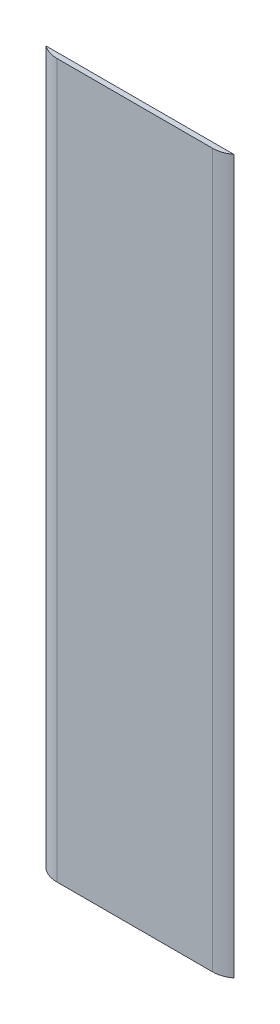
SolidWorks part; units mm, degrees
ref_plane "정면" through (0, 0, 0) normal (0, 0, 1) x (1, 0, 0)
ref_plane "윗면" through (0, 0, 0) normal (0, 1, 0) x (1, 0, 0)
ref_plane "우측면" through (0, 0, 0) normal (1, 0, 0) x (0, 0, -1)
sketch "스케치1" plane through (0, 0, 0) normal (0, 0, 1) x (1, 0, 0)
  line L1 (-17.5, -66.5) -> (17.5, -66.5)
  line L2 (-17.5, -66.5) -> (-17.5, 66.5)
  line L3 (-17.5, 66.5) -> (17.5, 66.5)
  line L4 (17.5, -66.5) -> (17.5, 66.5)
  line L5 (-17.5, -66.5) -> (17.5, 66.5) construction
  line L6 (-17.5, 66.5) -> (17.5, -66.5) construction
  point P0 (0, 0)
  dimension "D1" = 35
  dimension "D2" = 133
extrude "보스-돌출1" add sketch "스케치1" along normal blind 1
fillet "필렛1" radius 5 2 edges at (-17.5, 0, 1) (17.5, 0, 1)
sketch "스케치2" plane through (0, 0, 0) normal (0, 0, -1) x (-1, 0, 0)
  line L0 (-17.5, 66.5) -> (17.5, 66.5) construction
  line L5 (-15, 64) -> (15, 64)
  line L6 (-15, 64) -> (-15, -26)
  line L7 (-15, -26) -> (-14, -26)
  line L8 (15, 64) -> (15, -26)
  line L9 (-14, 63) -> (-14, -25)
  line L11 (14, 63) -> (14, -25)
  line L12 (-14, 63) -> (14, 63)
  line L13 (-14, -25) -> (-14, -26)
  line L14 (14, -25) -> (14, -26)
  line L15 (14, -26) -> (15, -26)
  line L16 (-14, -25) -> (14, -25) construction
  line L17 (-15, -26) -> (15, -26) construction
  point P4 (0, 64)
  dimension "D1" = 30
  dimension "D2" = 90
  dimension "D3" = 2.5
  dimension "D4" = 1
extrude "보스-돌출2" add sketch "스케치2" along normal blind 2
